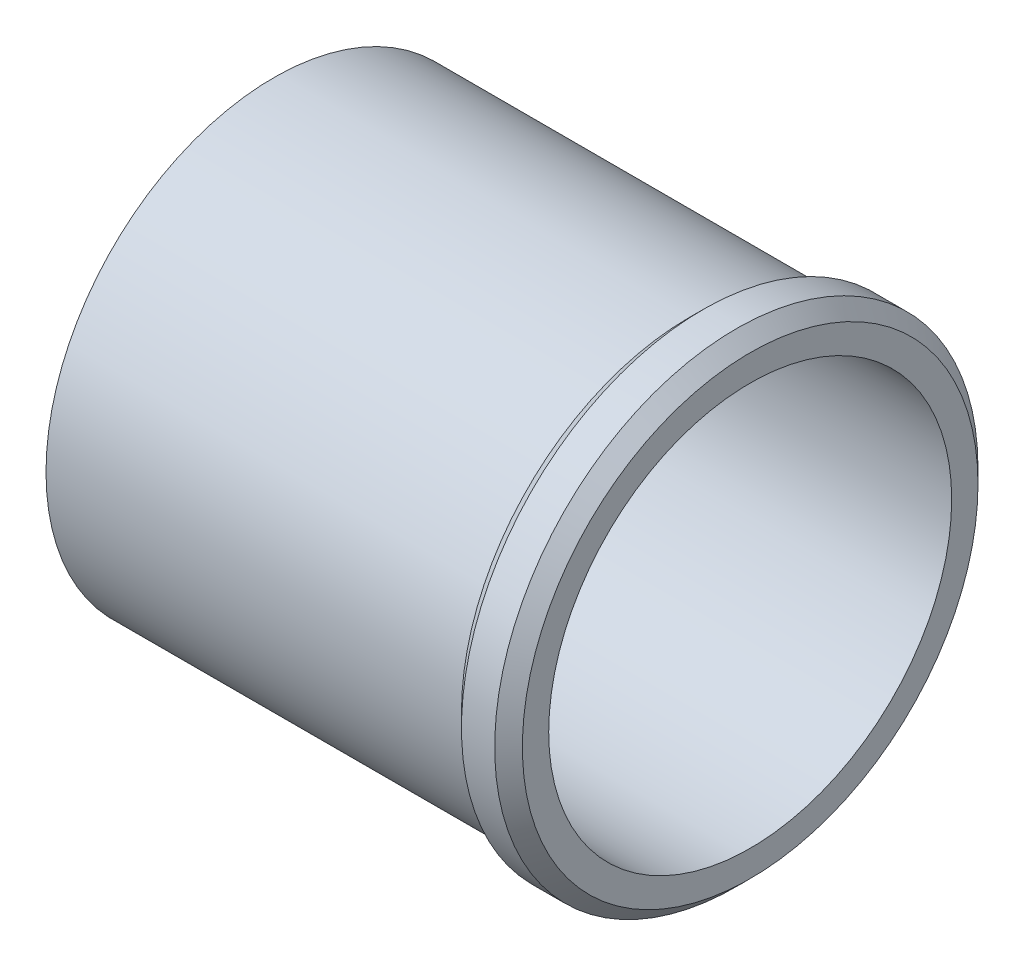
SolidWorks part; units mm, degrees
ref_plane "Front" through (0, 0, 0) normal (0, 0, 1) x (1, 0, 0)
ref_plane "Top" through (0, 0, 0) normal (0, 1, 0) x (1, 0, 0)
ref_plane "Right" through (0, 0, 0) normal (1, 0, 0) x (0, 0, -1)
sketch "Sketch1" plane through (0, 0, 0) normal (1, 0, 0) x (0, 0, -1)
  circle A0 centre (0, 0) radius 4.4323
  dimension "D1" = 8.8646
extrude "Base-Extrude" add sketch "Sketch1" along normal blind 8.7376
sketch "Sketch2" plane through (8.7376, 0, 0) normal (1, 0, 0) x (0, 0, -1)
  circle A0 centre (0, 0) radius 3.6957
  dimension "D1" = 7.3914
extrude "Cut-Extrude1" cut sketch "Sketch2" against normal blind 7.62
sketch "Sketch3" plane through (0, 0, 0) normal (1, 0, 0) x (0, 0, -1)
  circle A0 centre (0, 0) radius 3.4417
  dimension "D1" = 6.8834
extrude "Cut-Extrude2" cut sketch "Sketch3" along normal through all
sketch "Sketch4" plane through (0, 0, 0) normal (1, 0, 0) x (0, 0, -1)
  circle A0 centre (0, 0) radius 4.1783
  dimension "D1" = 8.3566
extrude "Cut-Extrude3" cut sketch "Sketch4" along normal blind 7.62 flip side to cut
chamfer "Chamfer1" distance 0.254 angle 45
